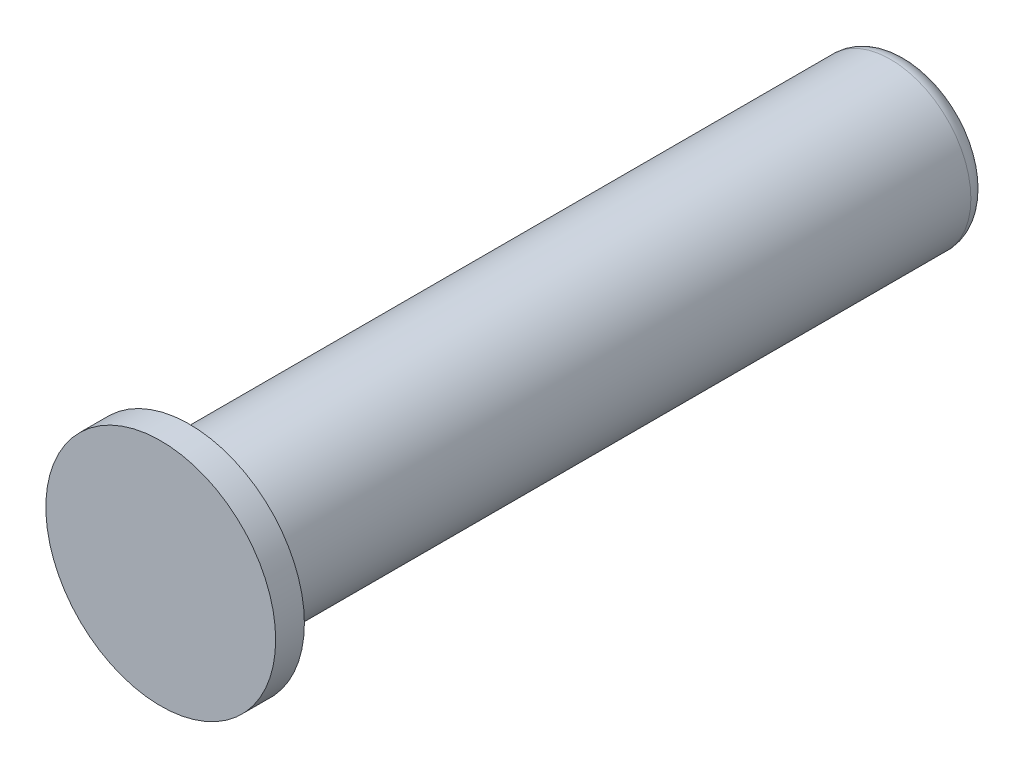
SolidWorks part; units mm, degrees
ref_plane "Front Plane" through (0, 0, 0) normal (0, 0, 1) x (1, 0, 0)
ref_plane "Top Plane" through (0, 0, 0) normal (0, 1, 0) x (1, 0, 0)
ref_plane "Right Plane" through (0, 0, 0) normal (1, 0, 0) x (0, 0, -1)
sketch "Sketch1" plane through (0, 0, 0) normal (1, 0, 0) x (0, 0, -1)
  line L0 (0, 0) -> (130, 0) construction
  line L1 (0, 0) -> (0, 20)
  line L2 (0, 20) -> (5, 20)
  line L3 (5, 20) -> (5, 14)
  line L4 (5, 14) -> (127, 14)
  line L5 (130, 11) -> (130, 3.5)
  line L6 (129.5, 3) -> (121, 3)
  line L7 (121, 3) -> (119.2679, 0)
  line L8 (130, 3.5) -> (129.5, 3)
  line L9 (0, 0) -> (119.2679, 0)
  arc A0 (127, 14) -> (130, 11) centre (127, 11) cw
  dimension "D4" = 3
  dimension "D1" = 14
  dimension "D2" = 20
  dimension "D3" = 5
  dimension "D5" = 9
  dimension "D6" = 3
  dimension "D7" = 60
  dimension "D8" = 125
  dimension "D9" = 45
  dimension "D10" = 0.5
revolve "Revolve1" add sketch "Sketch1" angle 360 about L0
